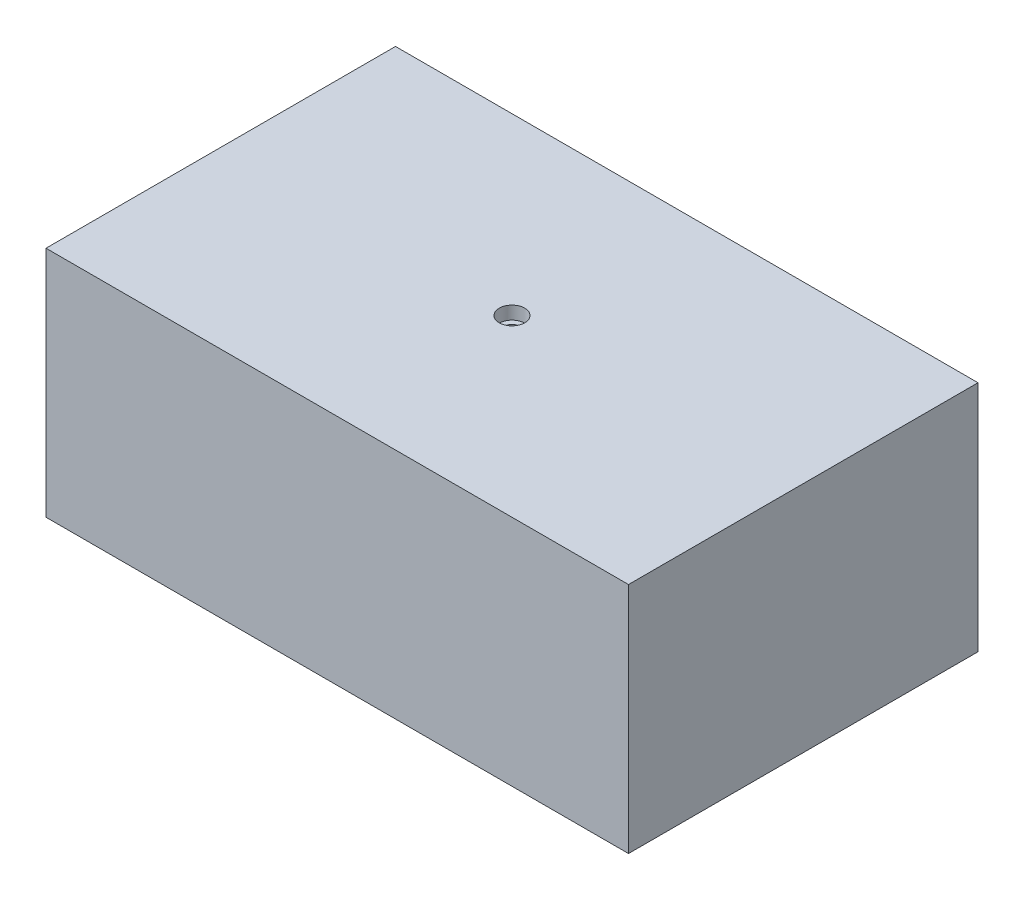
SolidWorks part; units mm, degrees
ref_plane "Front Plane" through (0, 0, 0) normal (0, 0, 1) x (1, 0, 0)
ref_plane "Top Plane" through (0, 0, 0) normal (0, 1, 0) x (1, 0, 0)
ref_plane "Right Plane" through (0, 0, 0) normal (1, 0, 0) x (0, 0, -1)
sketch "Sketch1" plane through (0, 0, 0) normal (0, 1, 0) x (1, 0, 0)
  line L1 (-63.5, -38.1) -> (63.5, -38.1)
  line L2 (-63.5, -38.1) -> (-63.5, 38.1)
  line L3 (-63.5, 38.1) -> (63.5, 38.1)
  line L4 (63.5, -38.1) -> (63.5, 38.1)
  line L5 (-63.5, -38.1) -> (63.5, 38.1) construction
  line L6 (-63.5, 38.1) -> (63.5, -38.1) construction
  point P0 (0, 0)
  dimension "D1" = 76.2
  dimension "D2" = 127
extrude "Boss-Extrude1" add sketch "Sketch1" along normal blind 50.8
hole_wizard "CBORE for #4 Socket Head Cap Screw1" positions "Sketch2" profile "Sketch4" counterbore size "#4" standard "ANSI Inch"
sketch "Sketch2" plane through (0, 50.8, 0) normal (0, 1, 0) x (1, 0, 0)
  point P0 (0, 0)
sketch "Sketch4" plane through (0, 50.8, 0) normal (1, 0, 0) x (0, 0, 1)
  line L0 (0, 0) -> (0, 50.8)
  line L1 (0, 50.8) -> (1.6319, 50.8)
  line L3 (1.6319, 50.8) -> (1.632, 2.8448)
  line L4 (1.632, 2.8448) -> (2.7788, 2.8448)
  line L5 (2.7788, 2.8448) -> (2.7788, 0)
  line L7 (2.7788, 0) -> (0, 0)
  line L11 (0, -6.35) -> (0, 107.95) construction
  dimension "Thru Hole Dia." = 3.2639
  dimension "Thru Hole Depth" = 50.8
  dimension "C'Bore Dia." = 5.5575
  dimension "C'Bore Depth" = 2.8448
